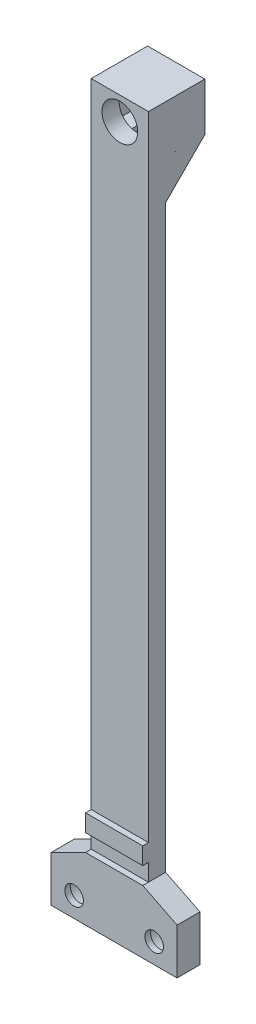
SolidWorks part; units mm, degrees
ref_plane "Front Plane" through (0, 0, 0) normal (0, 0, 1) x (1, 0, 0)
ref_plane "Top Plane" through (0, 0, 0) normal (0, 1, 0) x (1, 0, 0)
ref_plane "Right Plane" through (0, 0, 0) normal (1, 0, 0) x (0, 0, -1)
sketch "Croquis1" plane through (0, 0, 0) normal (0, 0, 1) x (1, 0, 0)
  line L0 (0, 0) -> (0, 107.8838) construction
  line L1 (-5, -62.5) -> (5, -62.5)
  line L2 (-5, -62.5) -> (-5, 62.5)
  line L3 (-5, 62.5) -> (5, 62.5)
  line L4 (5, -62.5) -> (5, 62.5)
  line L5 (-5, -62.5) -> (5, 62.5) construction
  line L6 (-5, 62.5) -> (5, -62.5) construction
  point P0 (0, 0)
  dimension "D1" = 10
  dimension "D2" = 125
extrude "Saliente-Extruir1" add sketch "Croquis1" along normal blind 3
sketch "Croquis2" plane through (0, 0, 3) normal (0, 0, 1) x (1, 0, 0)
  line L0 (-5, 62.5) -> (-5, -62.5) construction
  line L1 (5, -62.5) -> (-5, -62.5)
  line L2 (5, -62.5) -> (5, -53.5)
  line L3 (5, -53.5) -> (-5, -53.5)
  line L4 (-5, -62.5) -> (-5, -53.5)
  line L5 (5, -62.5) -> (5, 62.5) construction
  line L6 (-5, -47.5) -> (5, -47.5)
  line L7 (-5, -47.5) -> (-5, -50.5)
  line L8 (-5, -50.5) -> (5, -50.5)
  line L9 (5, -47.5) -> (5, -50.5)
  dimension "D1" = 3
  dimension "D2" = 9
  dimension "D3" = 15
extrude "Saliente-Extruir2" add sketch "Croquis2" along normal blind 1
sketch "Croquis3" plane through (0, 0, 3) normal (0, 0, 1) x (1, 0, 0)
  line L0 (5, 62.5) -> (-5, 62.5) construction
  circle A0 centre (0, 59.07) radius 3.125
  dimension "D1" = 6.25
  dimension "D2" = 3.43
extrude "Cortar-Extruir1" cut sketch "Croquis3" against normal blind 5
sketch "Croquis4" plane through (0, 0, 0) normal (0, 0, -1) x (-1, 0, 0)
  line L0 (5, -62.5) -> (11, -62.5)
  line L1 (11, -62.5) -> (11, -56.5)
  line L2 (11, -56.5) -> (5, -53.5)
  line L3 (0, -62.5) -> (0, -42.1015) construction
  line L4 (5, -62.5) -> (-5, -62.5) construction
  line L5 (5, -53.5) -> (5, -62.5)
  line L6 (-5, -53.5) -> (-5, -62.5)
  line L7 (-11, -56.5) -> (-5, -53.5)
  line L8 (-11, -62.5) -> (-11, -56.5)
  line L9 (-5, -62.5) -> (-11, -62.5)
  dimension "D1" = 6
  dimension "D2" = 6
extrude "Saliente-Extruir3" add sketch "Croquis4" against normal blind 4
sketch "Croquis12" plane through (0, 0, 4) normal (0, 0, 1) x (1, 0, 0)
  line L1 (-11, -62.5) -> (11, -62.5)
  line L2 (-11, -62.5) -> (-11, -64.5)
  line L3 (-11, -64.5) -> (11, -64.5)
  line L4 (11, -62.5) -> (11, -64.5)
  dimension "D1" = 2
extrude "Saliente-Extruir7" add sketch "Croquis12" against normal blind 4
sketch "Croquis8" plane through (0, 0, 0) normal (0, 0, -1) x (-1, 0, 0)
  line L0 (-5, 63.1185) -> (5, 63.1185)
  line L1 (5, 63.1185) -> (5, 54.6985)
  line L2 (5, 62.5) -> (5, -53.5) construction
  line L3 (5, 54.6985) -> (1.4887, 54.6985)
  line L4 (1.4887, 54.6985) -> (1.4887, 55.4985)
  line L5 (1.4887, 55.4985) -> (4.2, 55.4985)
  line L6 (4.2, 55.4985) -> (4.2, 62.3185)
  line L7 (4.2, 62.3185) -> (-4.2, 62.3185)
  line L8 (-4.2, 62.3185) -> (-4.2, 55.4993)
  line L10 (-0.9404, 54.6993) -> (-0.9404, 55.4993)
  line L12 (-5, -53.5) -> (-5, 62.5) construction
  line L13 (-5, 54.6993) -> (-5, 63.1185)
  line L14 (-5, 54.6993) -> (-0.9404, 54.6993)
  line L15 (-4.2, 55.4993) -> (-0.9404, 55.4993)
  dimension "D1" = 0.8
  dimension "D2" = 0.8
  dimension "D3" = 0.8
  dimension "D5" = 0.8
  dimension "D6" = 7.62
extrude "Saliente-Extruir4" add sketch "Croquis8" along normal blind 15 and the other way blind 3
sketch "Croquis10" plane through (-5, 0, 0) normal (-1, 0, 0) x (0, 0, 1)
  line L0 (-6.8475, 54.6985) -> (0, 47.851)
  line L1 (0, 54.6985) -> (-15, 54.6985) construction
  line L2 (0, 54.6985) -> (0, -53.5) construction
  line L3 (0, 47.851) -> (0, 54.6985)
  line L4 (0, 54.6985) -> (-6.8475, 54.6985)
  dimension "D1" = 45
extrude "Saliente-Extruir5" add sketch "Croquis10" against normal blind 10
sketch "Croquis11" plane through (0, 0, -15) normal (0, 0, -1) x (-1, 0, 0)
  line L0 (-5, 54.6993) -> (-0.9404, 54.6993) construction
  line L1 (-5, 54.6993) -> (5, 54.6993)
  line L2 (-5, 54.6993) -> (-5, 63.1185)
  line L3 (-5, 63.1185) -> (5, 63.1185)
  line L4 (5, 54.6993) -> (5, 63.1185)
  point P0 (0, 59.1424)
  dimension "D1" = 0
extrude "Saliente-Extruir6" add sketch "Croquis11" along normal blind 1
sketch "Croquis13" plane through (0, 0, 0) normal (0, 0, -1) x (-1, 0, 0)
  line L0 (-11, -61) -> (11, -61) construction
  line L1 (11, -64.5) -> (-11, -64.5) construction
  line L2 (-11, -56.5) -> (-11, -64.5) construction
  circle A0 centre (-7, -61) radius 3
  circle A1 centre (7, -61) radius 3
  dimension "D1" = 6
  dimension "D2" = 6
  dimension "D3" = 3.5
  dimension "D4" = 4
  dimension "D5" = 14
extrude "Cortar-Extruir2" cut sketch "Croquis13" against normal blind 3
sketch "Croquis14" plane through (0, 0, 3) normal (0, 0, -1) x (-1, 0, 0)
  circle A0 centre (-7, -61) radius 1.625
  circle A1 centre (7, -61) radius 1.625
  dimension "D1" = 3.25
  dimension "D2" = 3.25
extrude "Cortar-Extruir3" cut sketch "Croquis14" against normal blind 4
sketch "Sketch1" plane through (5, 0, 0) normal (1, 0, 0) x (0, 0, -1)
  line L1 (6.8475, 51.84) -> (19.1142, 51.84)
  line L2 (6.8475, 51.84) -> (6.8475, 64.8369)
  line L3 (6.8475, 64.8369) -> (19.1142, 64.8369)
  line L4 (19.1142, 51.84) -> (19.1142, 64.8369)
extrude "Cut-Extrude1" cut sketch "Sketch1" against normal blind 10
